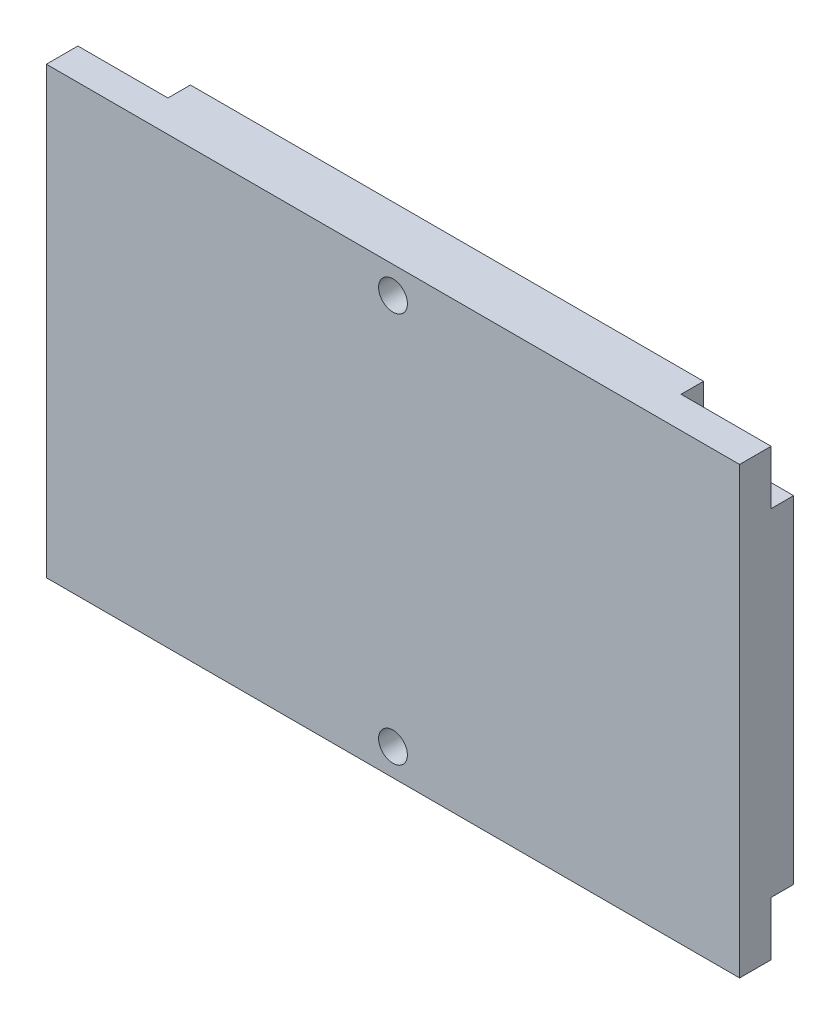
SolidWorks part; units mm, degrees
ref_plane "Plan de face" through (0, 0, 0) normal (0, 0, 1) x (1, 0, 0)
ref_plane "Plan de dessus" through (0, 0, 0) normal (0, 1, 0) x (1, 0, 0)
ref_plane "Plan de droite" through (0, 0, 0) normal (1, 0, 0) x (0, 0, -1)
sketch "Esquisse1" plane through (0, 0, 0) normal (0, 0, 1) x (1, 0, 0)
  line L0 (0, 39.8351) -> (0, -53.9381) construction
  line L1 (-28.5, 24.7) -> (28.5, 24.7)
  line L2 (-38.5, 18.7) -> (-38.5, -18.7)
  line L3 (-28.5, -24.7) -> (28.5, -24.7)
  line L4 (38.5, 18.7) -> (38.5, -18.7)
  line L5 (-38.5, 24) -> (38.5, -24) construction
  line L6 (-38.5, -24) -> (38.5, 24) construction
  line L7 (-53.4206, 18.7) -> (52.4763, 18.7) construction
  line L8 (-58.369, 0) -> (57.6722, 0) construction
  line L9 (-28.5, 35.134) -> (-28.5, 11.134) construction
  line L10 (-38.5, 18.7) -> (-30.7619, 18.7)
  line L11 (-28.5, 20.9619) -> (-28.5, 24.7)
  line L13 (28.5, 24.7) -> (28.5, 20.9619)
  line L14 (38.5, 18.7) -> (30.7619, 18.7)
  line L15 (38.5, -18.7) -> (30.7619, -18.7)
  line L16 (28.5, -20.9619) -> (28.5, -24.7)
  line L17 (-28.5, -20.9619) -> (-28.5, -24.7)
  line L18 (-38.5, -18.7) -> (-30.7619, -18.7)
  arc A0 (-30.7619, 18.7) -> (-28.5, 20.9619) centre (-29.6, 19.8) ccw
  arc A1 (30.7619, 18.7) -> (28.5, 20.9619) centre (29.6, 19.8) cw
  arc A2 (30.7619, -18.7) -> (28.5, -20.9619) centre (29.6, -19.8) ccw
  arc A3 (-30.7619, -18.7) -> (-28.5, -20.9619) centre (-29.6, -19.8) cw
  circle A4 centre (0, 21.7) radius 1.6
  circle A5 centre (0, -21.7) radius 1.6
  point P0 (0, 0)
  dimension "D5" = 1.1
  dimension "D7" = 3
  dimension "D1" = 18.7
  dimension "D2" = 77
  dimension "D3" = 10
  dimension "D4" = 6
  dimension "D6" = 1.1
extrude "Boss.-Extru.1" add sketch "Esquisse1" along normal blind 6
sketch "Esquisse2" plane through (0, 0, 6) normal (0, 0, 1) x (1, 0, 0)
  line L0 (28.5, 24.7) -> (-28.5, 24.7) construction
  line L1 (-25.2093, 24.7) -> (-38.5, 24.7)
  line L2 (-25.2093, 24.7) -> (-25.2093, 14.4551)
  line L3 (-25.2093, 14.4551) -> (-38.5, 14.4551)
  line L4 (-38.5, 24.7) -> (-38.5, 14.4551)
  line L5 (-38.5, 18.7) -> (-38.5, -18.7) construction
  line L6 (-28.5, -24.7) -> (28.5, -24.7) construction
  line L7 (-38.5, -13.6713) -> (-24.0773, -13.6713)
  line L8 (-38.5, -13.6713) -> (-38.5, -24.7)
  line L9 (-38.5, -24.7) -> (-24.0773, -24.7)
  line L10 (-24.0773, -13.6713) -> (-24.0773, -24.7)
  line L11 (38.5, -18.7) -> (38.5, 18.7) construction
  line L12 (22.0744, 24.7) -> (38.5, 24.7)
  line L13 (22.0744, 24.7) -> (22.0744, 12.0169)
  line L14 (22.0744, 12.0169) -> (38.5, 12.0169)
  line L15 (38.5, 24.7) -> (38.5, 12.0169)
  line L17 (38.5, -8.9691) -> (22.5969, -8.9691)
  line L18 (38.5, -8.9691) -> (38.5, -24.7)
  line L19 (38.5, -24.7) -> (22.5969, -24.7)
  line L20 (22.5969, -8.9691) -> (22.5969, -24.7)
extrude "Boss.-Extru.2" add sketch "Esquisse2" against normal blind 3.5
